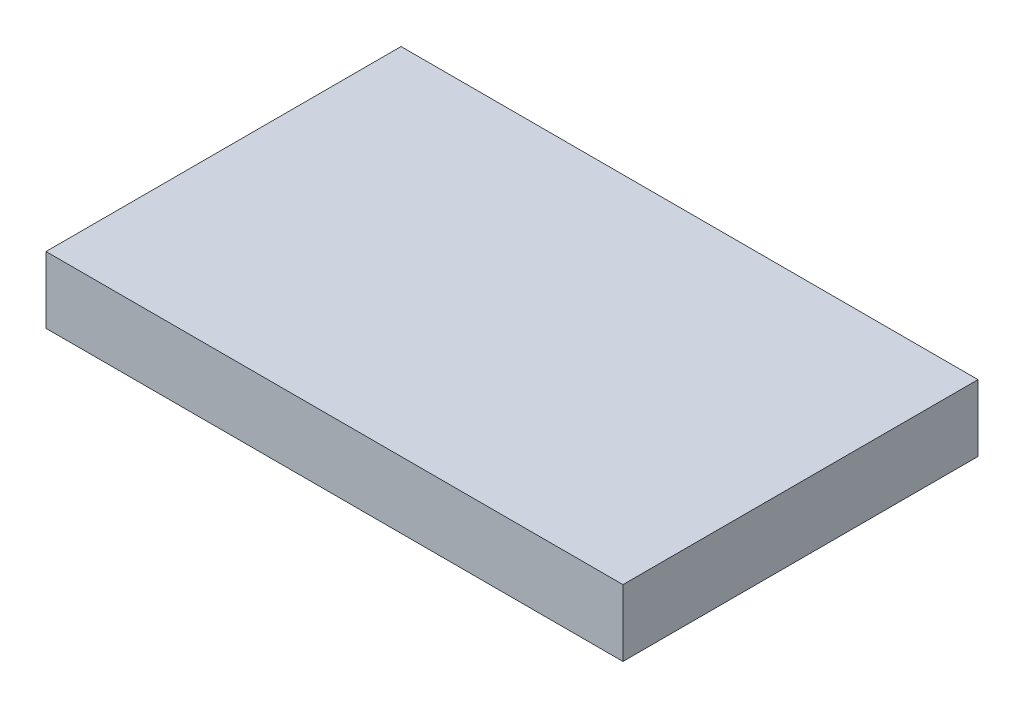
SolidWorks part; units mm, degrees
ref_plane "Front Plane" through (0, 0, 0) normal (0, 0, 1) x (1, 0, 0)
ref_plane "Top Plane" through (0, 0, 0) normal (0, 1, 0) x (1, 0, 0)
ref_plane "Right Plane" through (0, 0, 0) normal (1, 0, 0) x (0, 0, -1)
sketch "Sketch1" plane through (0, 0, 0) normal (0, 0, 1) x (1, 0, 0)
  line L1 (165.1, 19.05) -> (0, 19.05)
  line L2 (165.1, 19.05) -> (165.1, 0)
  line L3 (165.1, 0) -> (0, 0)
  line L4 (0, 19.05) -> (0, 0)
  dimension "D1" = 165.1
  dimension "D2" = 19.05
extrude "Extrude1" add sketch "Sketch1" along normal blind 101.6
